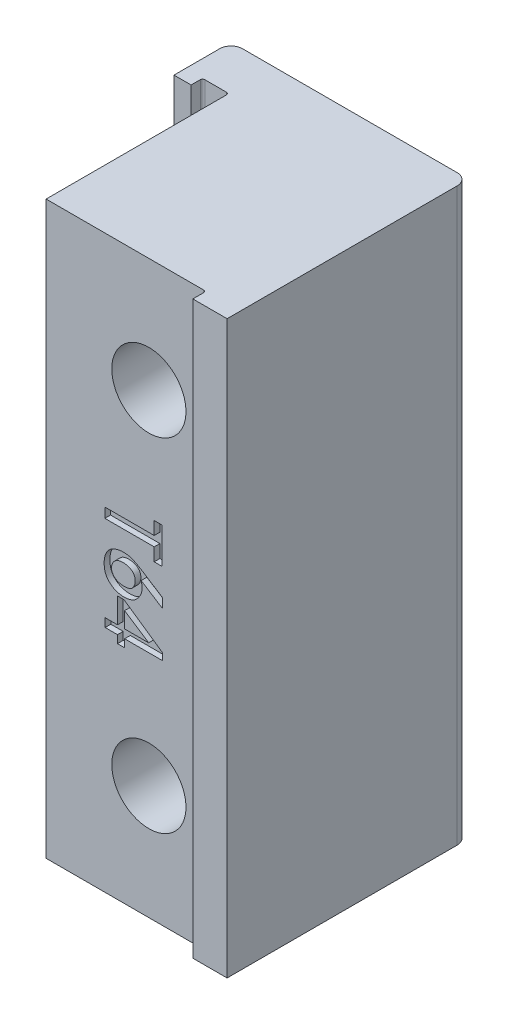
SolidWorks part; units mm, degrees
ref_plane "前视基准面" through (0, 0, 0) normal (0, 0, 1) x (1, 0, 0)
ref_plane "上视基准面" through (0, 0, 0) normal (0, 1, 0) x (1, 0, 0)
ref_plane "右视基准面" through (0, 0, 0) normal (1, 0, 0) x (0, 0, -1)
sketch "草图1" plane through (0, 0, 0) normal (0, 1, 0) x (1, 0, 0)
  line L0 (-20.8, -5) -> (-19.3, -5)
  line L1 (-3, -21.15) -> (0, -21.15)
  line L2 (-20.8, -5) -> (-20.8, 0)
  line L3 (-20.8, 0) -> (0, 0)
  line L4 (0, -21.15) -> (0, 0)
  line L7 (-19.3, -5) -> (-19.3, -4)
  line L8 (-19.3, -4) -> (-17, -4)
  line L9 (-17, -4) -> (-17, -20)
  line L10 (-17, -20) -> (-3, -20)
  line L11 (-3, -20) -> (-3, -21.15)
  point P0 (0, 0)
  dimension "D1" = 1.5
  dimension "D2" = 2.3
  dimension "D3" = 14
  dimension "D4" = 4
  dimension "D5" = 5
  dimension "D6" = 3
  dimension "D7" = 16
  dimension "D8" = 1.15
extrude "凸台-拉伸1" add sketch "草图1" along normal blind 50
hole_wizard "打孔尺寸(%根据)内六角圆柱头螺钉的类型0" positions "草图3" profile "草图2" counterbore size "M6" standard "GB"
sketch "草图3" plane through (0, 0, 0) normal (0, 0, -1) x (-1, 0, 0)
  line L0 (0, 25) -> (20.8, 25) construction
  line L1 (0, 50) -> (0, 0) construction
  line L2 (20.8, 50) -> (20.8, 0) construction
  point P0 (8, 40)
  point P2 (8, 10)
  dimension "D1" = 30
  dimension "D2" = 8
sketch "草图2" plane through (-8, 40, 0) normal (1, 0, 0) x (0, 1, 0)
  line L0 (0, 0) -> (0, 21.15)
  line L1 (0, 21.15) -> (3.25, 21.15)
  line L3 (3.25, 21.15) -> (3.25, 6.5)
  line L4 (3.25, 6.5) -> (5.5, 6.5)
  line L5 (5.5, 6.5) -> (5.5, 0)
  line L7 (5.5, 0) -> (0, 0)
  line L11 (0, -6.35) -> (0, 107.95) construction
  dimension "通孔孔直径" = 6.5
  dimension "通孔孔深度" = 21.15
  dimension "柱形沉头孔直径" = 11
  dimension "柱形沉头孔深度" = 6.5
fillet "圆角1" radius 0.2 1 edges at (-19.3, 25, 4)
fillet "圆角2" radius 0.2 1 edges at (-17, 25, 4)
fillet "圆角3" radius 0.2 1 edges at (-3, 25, 20)
fillet "圆角4" radius 1 1 edges at (0, 25, 0)
fillet "圆角5" radius 1 1 edges at (-20.8, 25, 0)
sketch "草图5" plane through (0, 0, 20) normal (0, 0, 1) x (1, 0, 0)
  line L0 (-12, 50) -> (-12, 0) construction
  line L1 (-17, 50) -> (-3.2, 50) construction
  line L2 (-17, 0) -> (-3.2, 0) construction
  line L3 (-17, 50) -> (-17, 0) construction
  text T0 "T64" font "黑体" height 5
  dimension "D1" = 5
extrude "切除-拉伸2" cut sketch "草图5" against normal blind 0.5
